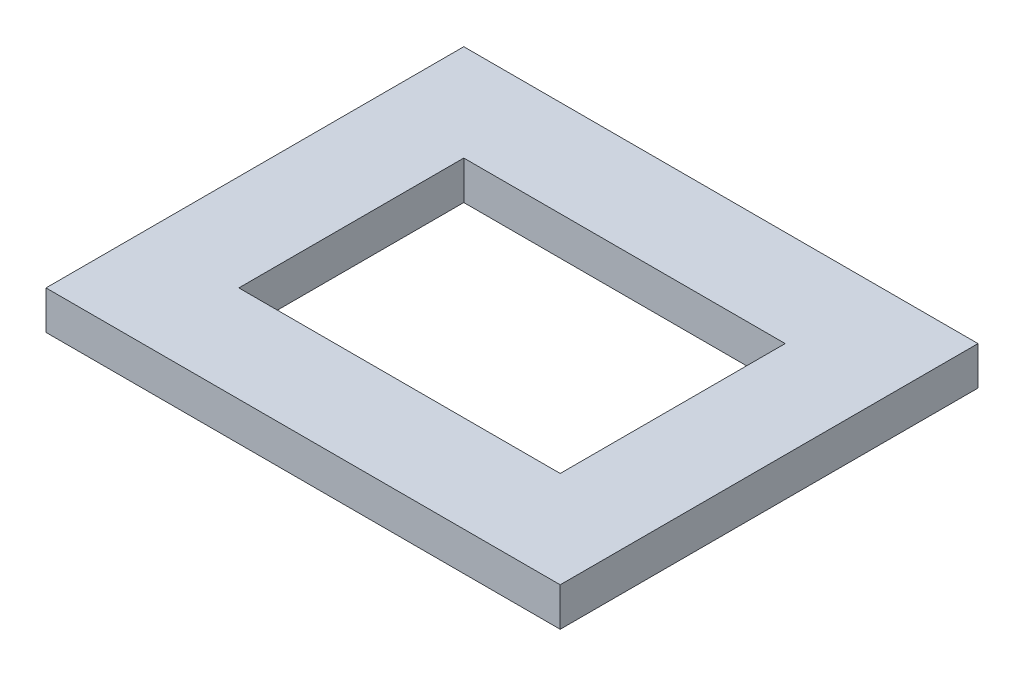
SolidWorks part; units mm, degrees
ref_plane "Front Plane" through (0, 0, 0) normal (0, 0, 1) x (1, 0, 0)
ref_plane "Top Plane" through (0, 0, 0) normal (0, 1, 0) x (1, 0, 0)
ref_plane "Right Plane" through (0, 0, 0) normal (1, 0, 0) x (0, 0, -1)
sketch "Sketch1" plane through (0, 0, 0) normal (0, 1, 0) x (1, 0, 0)
  line L0 (-101.6, 82.55) -> (101.6, 82.55)
  line L1 (-63.5, 44.45) -> (63.5, 44.45)
  line L2 (-63.5, 44.45) -> (-63.5, -44.45)
  line L3 (-63.5, -44.45) -> (63.5, -44.45)
  line L4 (63.5, 44.45) -> (63.5, -44.45)
  line L5 (-63.5, 44.45) -> (63.5, -44.45) construction
  line L6 (-63.5, -44.45) -> (63.5, 44.45) construction
  line L7 (101.6, 82.55) -> (101.6, -82.55)
  line L8 (-101.6, -82.55) -> (101.6, -82.55)
  line L9 (-101.6, 82.55) -> (-101.6, -82.55)
  point P0 (0, 0)
  dimension "D1" = 88.9
  dimension "D2" = 127
  dimension "D3" = 38.1
extrude "Boss-Extrude1" add sketch "Sketch1" along normal mid plane 15.24
